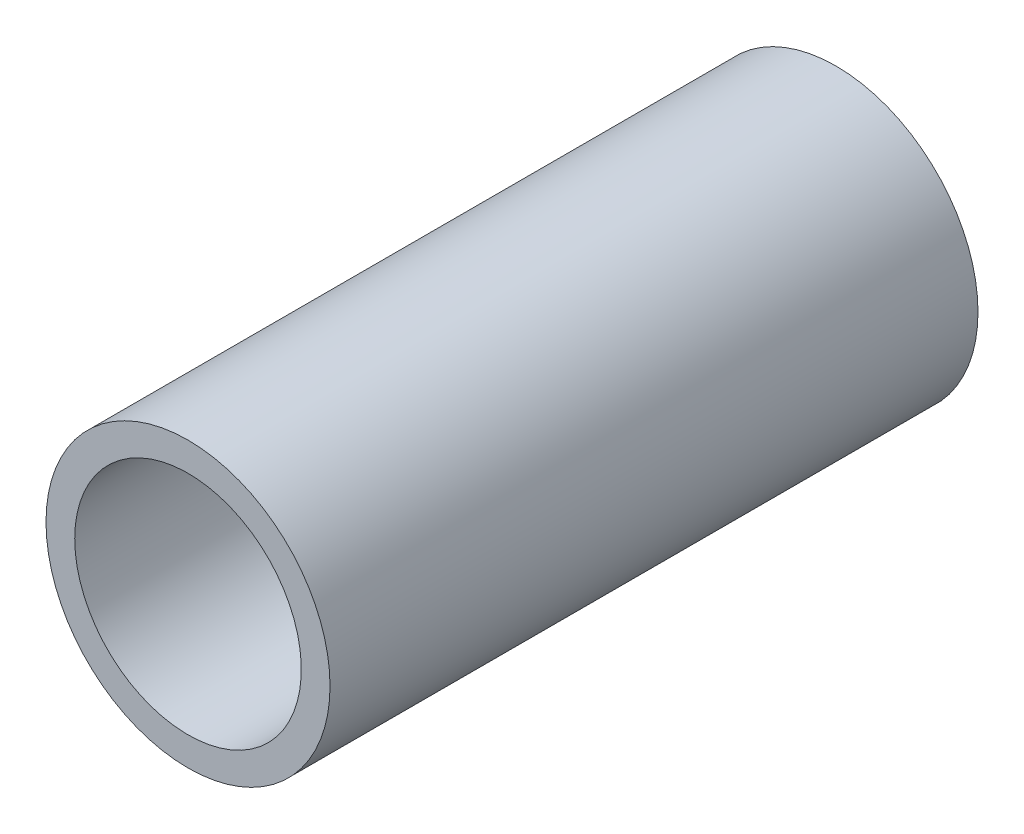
SolidWorks part; units mm, degrees
ref_plane "Front Plane" through (0, 0, 0) normal (0, 0, 1) x (1, 0, 0)
ref_plane "Top Plane" through (0, 0, 0) normal (0, 1, 0) x (1, 0, 0)
ref_plane "Right Plane" through (0, 0, 0) normal (1, 0, 0) x (0, 0, -1)
sketch "Sketch1" plane through (0, 0, 0) normal (0, 0, 1) x (1, 0, 0)
  circle A0 centre (0, 0) radius 16.7005
  circle A1 centre (0, 0) radius 13.3223
  dimension "D1" = 33.401
  dimension "D2" = 3.3782
extrude "Extrude1" add sketch "Sketch1" along normal blind 76.2
